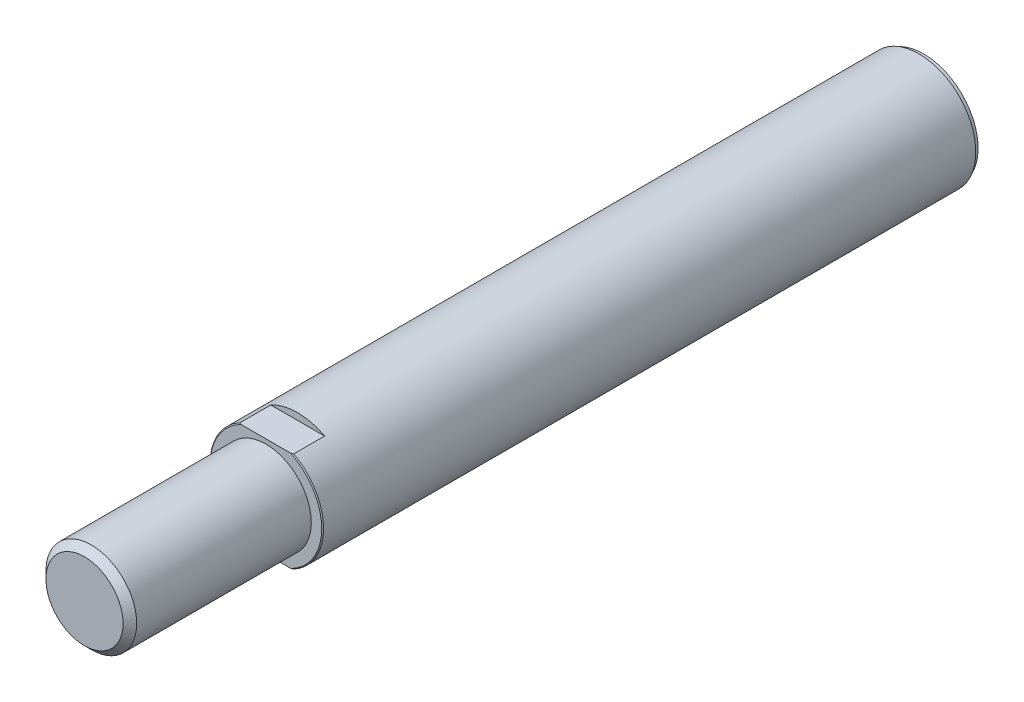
SolidWorks part; units mm, degrees
ref_plane "Plano frontal" through (0, 0, 0) normal (0, 0, 1) x (1, 0, 0)
ref_plane "Plano superior" through (0, 0, 0) normal (0, 1, 0) x (1, 0, 0)
ref_plane "Plano direito" through (0, 0, 0) normal (1, 0, 0) x (0, 0, -1)
sketch "Esboço1" plane through (0, 0, 0) normal (0, 0, 1) x (1, 0, 0)
  circle A0 centre (0, 0) radius 12.5
  dimension "D1" = 25
extrude "Ressalto-extrusão1" add sketch "Esboço1" along normal blind 185
sketch "Esboço2" plane through (0, 0, 185) normal (0, 0, 1) x (1, 0, 0)
  circle A0 centre (0, 0) radius 10
  dimension "D1" = 20
extrude "Corte-extrusão1" cut sketch "Esboço2" against normal blind 40 flip side to cut
chamfer "Chanfro1" distance 0.2 angle 45 1 edges at (12.5, 0, 145)
sketch "Esboço3" plane through (0, 0, 145) normal (0, 0, 1) x (1, 0, 0)
  line L1 (-18.9676, -11) -> (18.9676, -11)
  line L2 (-18.9676, -11) -> (-18.9676, 11)
  line L3 (-18.9676, 11) -> (18.9676, 11)
  line L4 (18.9676, -11) -> (18.9676, 11)
  line L5 (-18.9676, -11) -> (18.9676, 11) construction
  line L6 (-18.9676, 11) -> (18.9676, -11) construction
  point P0 (0, 0)
  dimension "D1" = 22
extrude "Corte-extrusão2" cut sketch "Esboço3" against normal blind 7 flip side to cut
chamfer "Chanfro2" distance 1.5 angle 45 1 edges at (10, 0, 185)
sketch "Esboço4" plane through (0, 0, 0) normal (0, 0, -1) x (-1, 0, 0)
  circle A0 centre (0, 0) radius 12
  dimension "D1" = 24
extrude "Corte-extrusão3" cut sketch "Esboço4" against normal blind 1 flip side to cut
hole_wizard "Furo roscado de M12x1.751" positions "Esboço5" profile "Esboço6" tap size "M12x1.75" standard "Ansi Metric"
sketch "Esboço5" plane through (0, 0, 0) normal (0, 0, -1) x (-1, 0, 0)
  point P0 (0, 0)
sketch "Esboço6" plane through (0, 0, 0) normal (1, 0, 0) x (0, 1, 0)
  line L0 (0, 0) -> (0, 35.8144)
  line L1 (0, 35.8144) -> (5.1, 32.75)
  line L2 (5.1, 32.75) -> (5.1, 0)
  line L5 (5.1, 0) -> (0, 0)
  line L10 (0, 35.8144) -> (-5.1, 32.75) construction
  line L11 (0, -6.35) -> (0, 107.95) construction
  dimension "Tap Drill Dia." = 10.2
  dimension "Tap Drill Depth" = 32.75
  dimension "Drill Angle" = 118
